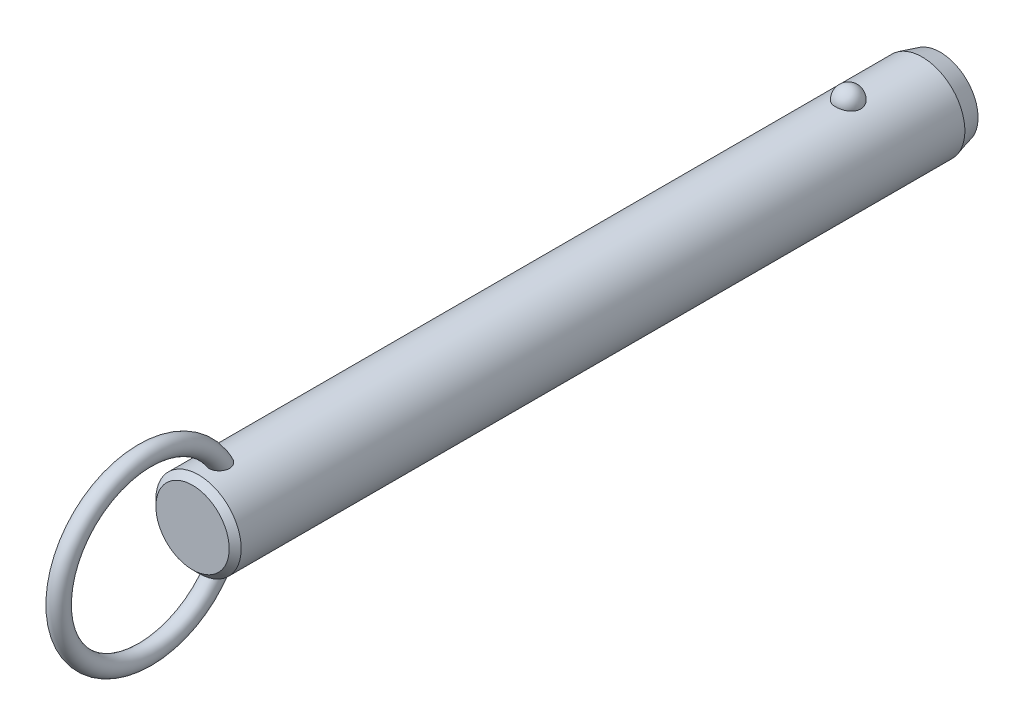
SolidWorks part; units mm, degrees
ref_plane "Front Plane" through (0, 0, 0) normal (0, 0, 1) x (1, 0, 0)
ref_plane "Top Plane" through (0, 0, 0) normal (0, 1, 0) x (1, 0, 0)
ref_plane "Right Plane" through (0, 0, 0) normal (1, 0, 0) x (0, 0, -1)
sketch "Sketch2" plane through (0, 0, 0) normal (0, 0, 1) x (1, 0, 0)
  circle A0 centre (0, 0) radius 7.1
  point P3 (0, 7.1)
  dimension "D1" = 14.2
extrude "Boss-Extrude1" add sketch "Sketch2" along normal blind 99.1
sketch "Sketch3" plane through (0, 0, 0) normal (0, 0, -1) x (-1, 0, 0)
  circle A0 centre (0, 0) radius 7.1
  dimension "D1" = 14.2
extrude "Boss-Extrude2" add sketch "Sketch3" along normal blind 17.4
chamfer "Chamfer1" distance 3 angle 15 1 edges at (-7.1, 0, -17.4)
sketch "Sketch12" plane through (0, 0, 0) normal (1, 0, 0) x (0, 0, -1)
  line L0 (-99.1, 7.1) -> (-99.1, -7.1) construction
  point P0 (-99.1, 0)
sketch "Sketch13" plane through (0, 0, 0) normal (1, 0, 0) x (0, 0, -1)
  circle A0 centre (-114.95, 0) radius 15.85
  point P2 (-99.1, 0)
  dimension "D1" = 31.7
sketch "Sketch14" plane through (0, 0, 0) normal (0, 1, 0) x (1, 0, 0)
  circle A0 centre (0, -100.6) radius 1.5
  point P2 (0, -99.1)
  dimension "D1" = 3
sweep "Sweep1" add profiles "Sketch14" path "Sketch13"
sketch "Sketch15" plane through (0, 0, 99.1) normal (0, 0, 1) x (1, 0, 0)
  circle A0 centre (0, 0) radius 7.1
  dimension "D1" = 14.2
extrude "Boss-Extrude3" add sketch "Sketch15" along normal blind 7.92
chamfer "Chamfer2" distance 1 angle 45 1 edges at (7.1, 0, 107.02)
sketch "Sketch18" plane through (0, 0, 0) normal (1, 0, 0) x (0, 0, -1)
  line L0 (14.4, 7.1) -> (-100.7792, 7.1) construction
  line L1 (2.1, 9.2) -> (2.1, 5)
  line L2 (-100.7792, -7.1) -> (14.4, -7.1) construction
  arc A0 (2.1, 9.2) -> (2.1, 5) centre (2.1, 7.1) ccw
  point P4 (0, 7.1)
  dimension "D1" = 16.3
revolve "Revolve1" add sketch "Sketch18" angle 360 about L1
